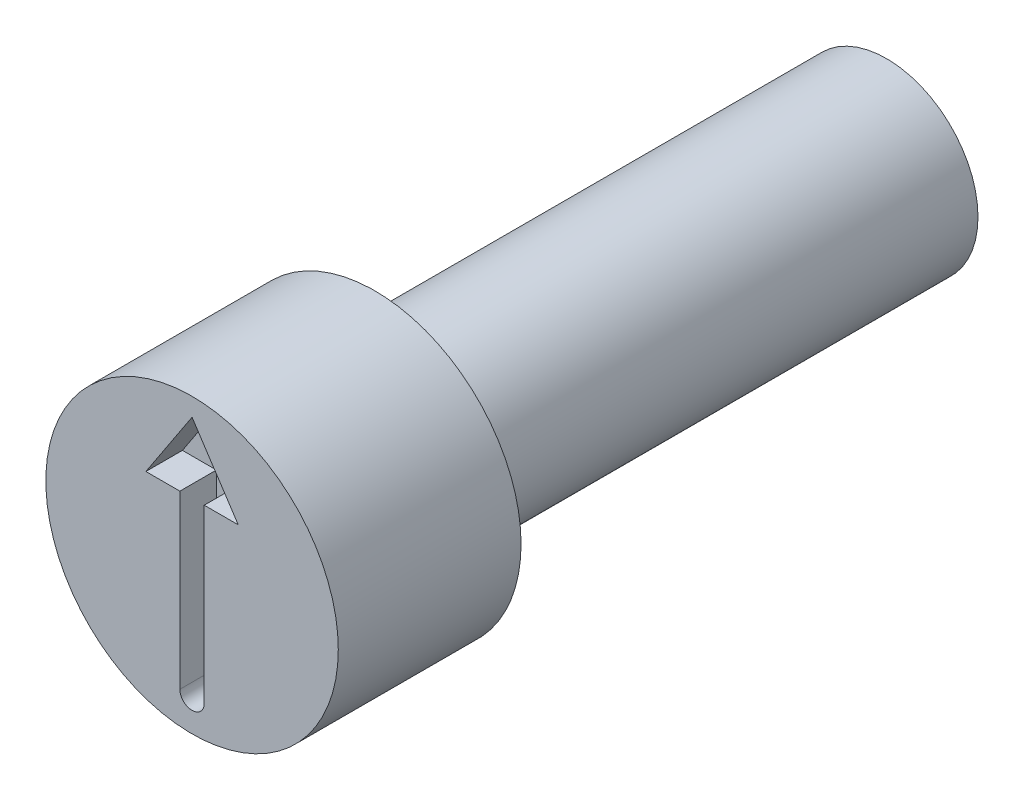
SolidWorks part; units mm, degrees
ref_plane "Front Plane" through (0, 0, 0) normal (0, 0, 1) x (1, 0, 0)
ref_plane "Top Plane" through (0, 0, 0) normal (0, 1, 0) x (1, 0, 0)
ref_plane "Right Plane" through (0, 0, 0) normal (1, 0, 0) x (0, 0, -1)
sketch "Sketch2" plane through (0, 0, 0) normal (1, 0, 0) x (0, 0, -1)
  line L0 (0.4039, 0) -> (50000.4039, 0) construction
  line L6 (0, 0.8) -> (0, 0)
  line L7 (1, 0.8) -> (0, 0.8)
  line L8 (1, 0.5) -> (1, 0.8)
  line L9 (3.8, 0.5) -> (1, 0.5)
  line L10 (3.8, 0) -> (3.8, 0.5)
  line L11 (0, 0) -> (3.8, 0)
  dimension "D1" = 1.6
  dimension "D2" = 1
  dimension "D3" = 3.8
  dimension "D4" = 1
revolve "Revolve1" add sketch "Sketch2" angle 360 about L0
sketch "Sketch3" plane through (0, 0, 0) normal (0, 0, 1) x (1, 0, 0)
  line L0 (0, 0) -> (0, 35000) construction
  line L1 (0.0667, 0.3172) -> (0.0667, -0.6217)
  line L2 (0.2527, 0.3172) -> (0.0667, 0.3172)
  line L3 (0, 0.7007) -> (0.2527, 0.3172)
  line L15 (0, 0.7007) -> (-0.2527, 0.3172)
  line L16 (-0.2527, 0.3172) -> (-0.0667, 0.3172)
  line L17 (-0.0667, 0.3172) -> (-0.0667, -0.6217)
  arc A2 (-0.0667, -0.6217) -> (0.0667, -0.6217) centre (0, -0.6217) ccw
extrude "Cut-Extrude4" cut sketch "Sketch3" against normal blind 0.2
